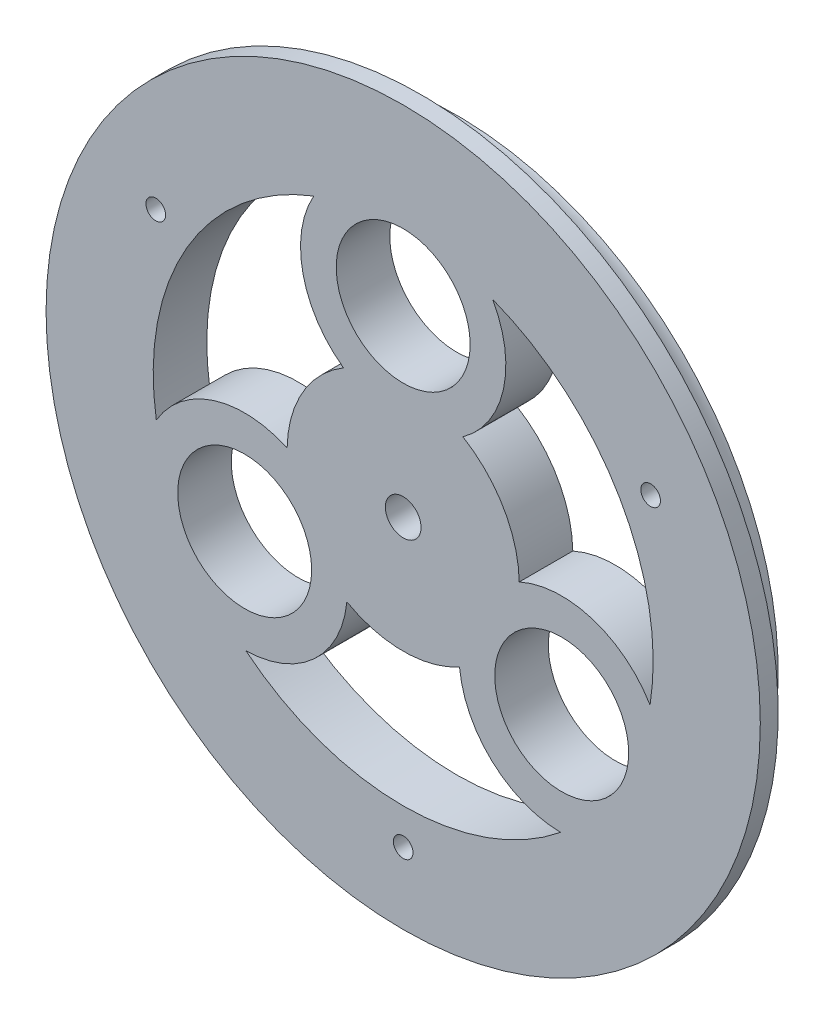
SolidWorks part; units mm, degrees
ref_plane "Plan de face" through (0, 0, 0) normal (0, 0, 1) x (1, 0, 0)
ref_plane "Plan de dessus" through (0, 0, 0) normal (0, 1, 0) x (1, 0, 0)
ref_plane "Plan de droite" through (0, 0, 0) normal (1, 0, 0) x (0, 0, -1)
sketch "Esquisse1" plane through (0, 0, 0) normal (0, 0, 1) x (1, 0, 0)
  line L0 (-92.4278, 0) -> (45.3907, 0) construction
  line L1 (0, 44.6852) -> (0, -91.2519) construction
  line L4 (0, 0) -> (-45.7689, 26.4247) construction
  circle A0 centre (0, 0) radius 40
  arc A2 (27.6526, -4.397) -> (10.0184, 26.1463) centre (0, 0) ccw
  circle A3 centre (0, 0) radius 32 construction
  circle A4 centre (0, 0) radius 2
  arc A5 (12.9981, 0.2207) -> (6.6902, 11.1463) centre (0, 0) ccw
  circle A6 centre (-27.7128, 16) radius 1.1
  circle A7 centre (0, 0) radius 12 construction
  circle A8 centre (0, 0) radius 20.5 construction
  circle A9 centre (27.7128, 16) radius 1.1
  circle A10 centre (0, 20.5) radius 7.5
  circle A11 centre (0, -32) radius 1.1
  arc A12 (-10.0184, 26.1463) -> (-6.6902, 11.1463) centre (0, 20.5) ccw
  circle A13 centre (17.7535, -10.25) radius 7.5
  arc A14 (27.6526, -4.397) -> (12.9981, 0.2207) centre (17.7535, -10.25) ccw
  circle A15 centre (-17.7535, -10.25) radius 7.5
  arc A16 (-17.6342, -21.7494) -> (-6.3079, -11.3671) centre (-17.7535, -10.25) ccw
  arc A17 (6.3079, -11.3671) -> (17.6342, -21.7494) centre (17.7535, -10.25) ccw
  arc A18 (-17.6342, -21.7494) -> (17.6342, -21.7494) centre (0, 0) ccw
  arc A19 (-12.9981, 0.2207) -> (-27.6526, -4.397) centre (-17.7535, -10.25) ccw
  arc A20 (-6.3079, -11.3671) -> (6.3079, -11.3671) centre (0, 0) ccw
  arc A21 (-10.0184, 26.1463) -> (-27.6526, -4.397) centre (0, 0) ccw
  arc A22 (6.6902, 11.1463) -> (10.0184, 26.1463) centre (0, 20.5) ccw
  circle A23 centre (-17.7535, -10.25) radius 9.5
  circle A24 centre (0, 20.5) radius 9.5
  circle A25 centre (17.7535, -10.25) radius 9.5
  arc A26 (-6.6902, 11.1463) -> (-12.9981, 0.2207) centre (0, 0) ccw
  dimension "D3" = 60
extrude "Extrusion1" add sketch "Esquisse1" along normal blind 6
sketch "Esquisse2" plane through (0, 0, 0) normal (0, 0, -1) x (-1, 0, 0)
  circle A0 centre (0, 0) radius 36
  circle A1 centre (0, 0) radius 41
extrude "Enlèv. mat.-Extru.1" cut sketch "Esquisse2" against normal blind 4
fillet "Congé1" radius 4 1 edges at (-36, 0, 4)
